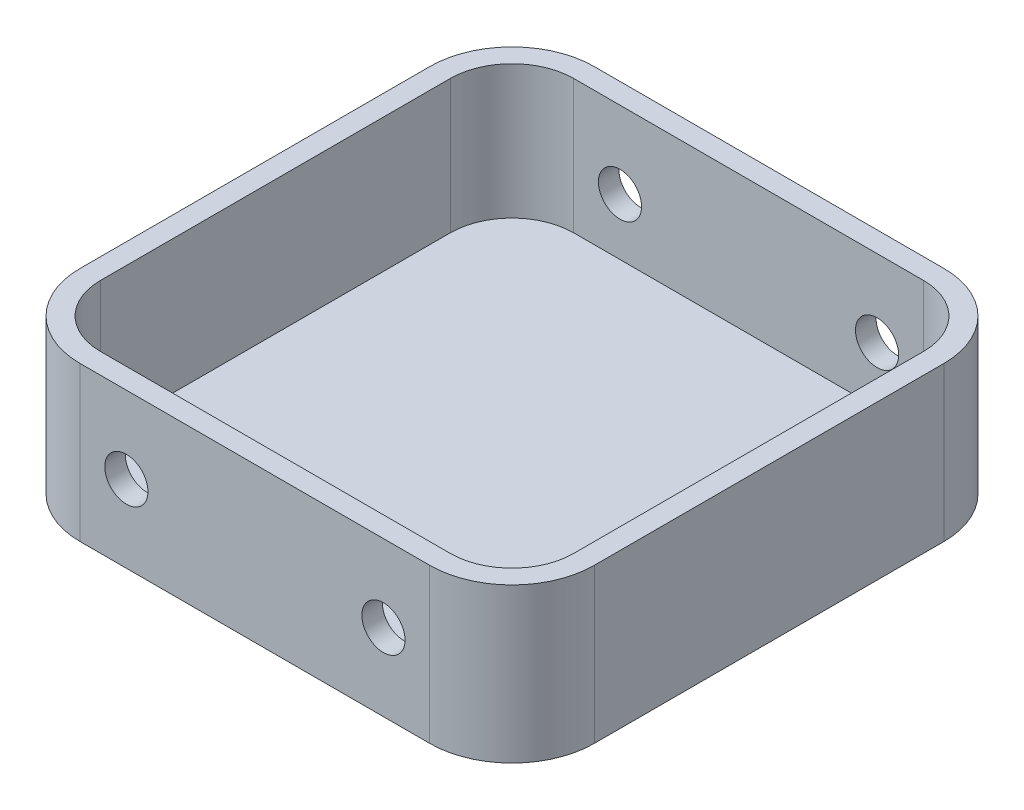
SolidWorks part; units mm, degrees
ref_plane "前视基准面" through (0, 0, 0) normal (0, 0, 1) x (1, 0, 0)
ref_plane "上视基准面" through (0, 0, 0) normal (0, 1, 0) x (1, 0, 0)
ref_plane "右视基准面" through (0, 0, 0) normal (1, 0, 0) x (0, 0, -1)
sketch "草图1" plane through (0, 0, 0) normal (0, 1, 0) x (1, 0, 0)
  line L1 (-25, 25) -> (25, 25)
  line L2 (-25, 25) -> (-25, -25)
  line L3 (-25, -25) -> (25, -25)
  line L4 (25, 25) -> (25, -25)
  line L5 (-25, 25) -> (25, -25) construction
  line L6 (-25, -25) -> (25, 25) construction
  point P0 (0, 0)
  dimension "D1" = 50
  dimension "D2" = 50
extrude "凸台-拉伸1" add sketch "草图1" along normal blind 15
fillet "圆角1" radius 8 4 edges at (25, 7.5, 25) (-25, 7.5, 25) (25, 7.5, -25) (-25, 7.5, -25)
shell "抽壳1" thickness 2
sketch "草图2" plane through (0, 0, -25) normal (0, 0, -1) x (-1, 0, 0)
  line L0 (17, 7.5) -> (-32.6054, 7.5) construction
  line L1 (17, 0) -> (17, 15) construction
  line L2 (0, 0) -> (0, 23.717) construction
  line L3 (-17, 0) -> (17, 0) construction
  circle A0 centre (12.5, 7.5) radius 2.1
  circle A1 centre (-12.5, 7.5) radius 2.1
  dimension "D1" = 25
  dimension "D2" = 4.2
extrude "切除-拉伸1" cut sketch "草图2" against normal through all
